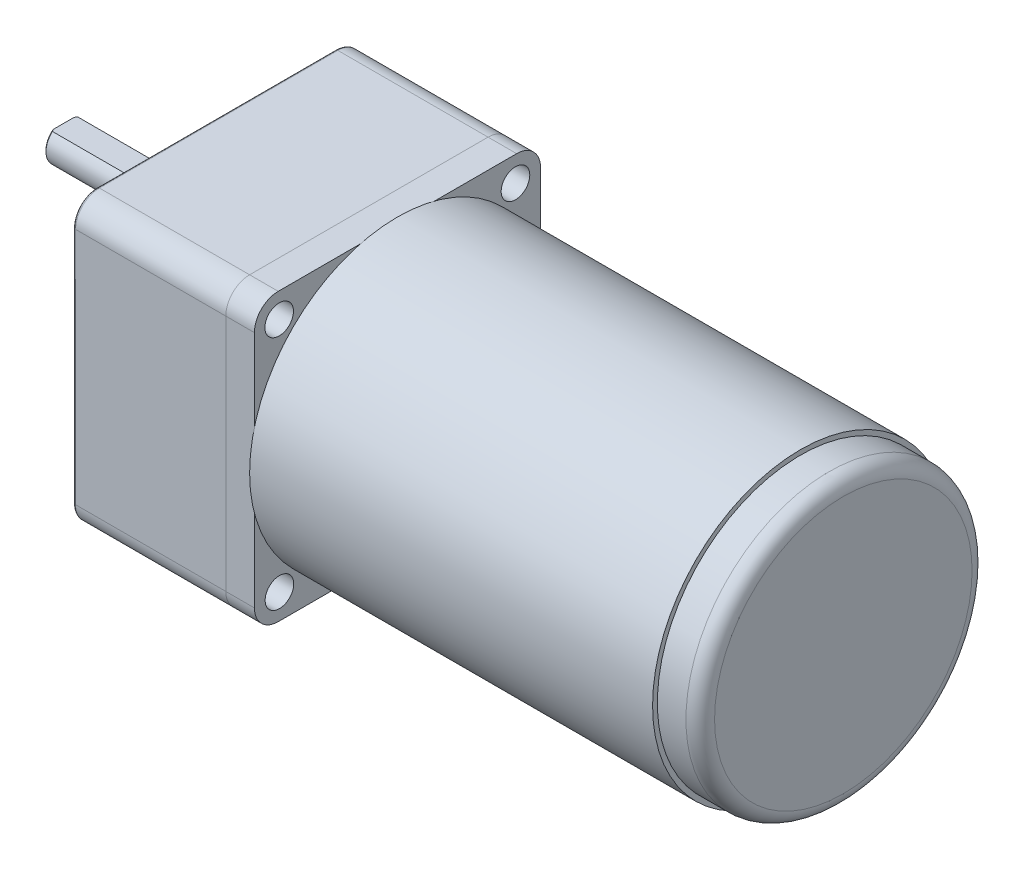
SolidWorks part; units mm, degrees
ref_plane "前视基准面" through (0, 0, 0) normal (0, 0, 1) x (1, 0, 0)
ref_plane "上视基准面" through (0, 0, 0) normal (0, 1, 0) x (1, 0, 0)
ref_plane "右视基准面" through (0, 0, 0) normal (1, 0, 0) x (0, 0, -1)
sketch "草图1" plane through (0, 0, 0) normal (1, 0, 0) x (0, 0, -1)
  line L1 (-25, -30) -> (25, -30)
  line L2 (-30, -25) -> (-30, 25)
  line L3 (-25, 30) -> (25, 30)
  line L4 (30, -25) -> (30, 25)
  line L5 (-30, -30) -> (30, 30) construction
  line L6 (-30, 30) -> (30, -30) construction
  arc A0 (-25, -30) -> (-30, -25) centre (-25, -25) cw
  arc A1 (25, -30) -> (30, -25) centre (25, -25) ccw
  arc A2 (25, 30) -> (30, 25) centre (25, 25) cw
  arc A3 (-30, 25) -> (-25, 30) centre (-25, 25) cw
  point P0 (0, 0)
  dimension "D1" = 5
extrude "凸台-拉伸1" add sketch "草图1" along normal blind 32
sketch "草图2" plane through (32, 0, 0) normal (1, 0, 0) x (0, 0, -1)
  line L0 (25, 30) -> (-25, 30) construction
  line L1 (-25, -30) -> (25, -30)
  line L2 (-30, -25) -> (-30, 25)
  line L3 (-25, 30) -> (25, 30)
  line L4 (30, -25) -> (30, 25)
  line L5 (-30, -30) -> (30, 30) construction
  line L6 (-30, 30) -> (30, -30) construction
  arc A0 (25, 30) -> (30, 25) centre (25, 25) cw
  arc A1 (25, -30) -> (30, -25) centre (25, -25) ccw
  arc A2 (-25, -30) -> (-30, -25) centre (-25, -25) cw
  arc A3 (-30, 25) -> (-25, 30) centre (-25, 25) cw
  point P0 (0, 0)
  dimension "D1" = 5
extrude "凸台-拉伸2" add sketch "草图2" along normal blind 6 separate body
sketch "草图5" plane through (0, 0, 0) normal (-1, 0, 0) x (0, 0, 1)
  circle A0 centre (0, 10) radius 12
extrude "凸台-拉伸5" add sketch "草图5" along normal blind 3 separate body
sketch "草图6" plane through (-3, 0, 0) normal (-1, 0, 0) x (0, 0, 1)
  circle A0 centre (0, 10) radius 4
extrude "凸台-拉伸6" add sketch "草图6" along normal blind 29 separate body
fillet "圆角2" radius 0.5 1 edges at (-3, 10, 12)
sketch "草图7" plane through (-32, 0, 0) normal (-1, 0, 0) x (0, 0, 1)
  line L2 (2.6458, 13) -> (-2.6458, 13)
  arc A0 (2.6458, 13) -> (-2.6458, 13) centre (0, 10) ccw
extrude "切除-拉伸1" cut sketch "草图7" against normal blind 25
chamfer "倒角1" distance 0.3 angle 45 1 edges at (-32, 6, 0)
sketch "草图8" plane through (0, 0, 0) normal (-1, 0, 0) x (0, 0, 1)
  circle A0 centre (0, 0) radius 26.3
extrude "切除-拉伸2" cut sketch "草图8" against normal blind 0.5
fillet "圆角3" radius 0.5 1 edges at (0, 0, 26.3)
fillet "圆角4" radius 0.5 8 edges at (0, -30, 0) (0, -28.5355, -28.5355) (0, 0, -30) (0, 28.5355, -28.5355) (0, 30, 0) (0, 28.5355, 28.5355) (0, 0, 30) (0, -28.5355, 28.5355)
sketch "草图9" plane through (0, 0, 0) normal (-1, 0, 0) x (0, 0, 1)
  point P19 (-24.7487, 24.7487)
  point P20 (24.7487, 24.7487)
  point P21 (24.7487, -24.7487)
  point P22 (-24.7487, -24.7487)
hole_wizard "M4 螺纹孔1" positions "3D草图1" profile "草图10" tap size "M4" standard "GB"
sketch3d "3D草图1"
  point P0 (0, 24.7487, -24.7487)
  point P3 (0, 24.7487, 24.7487)
  point P6 (0, -24.7487, 24.7487)
  point P9 (0, -24.7487, -24.7487)
sketch "草图10" plane through (0, 24.7487, -24.7487) normal (0, 1, 0) x (0, 0, 1)
  line L0 (0, 0) -> (0, 12.9914)
  line L1 (0, 12.9914) -> (1.65, 12)
  line L2 (1.65, 12) -> (1.65, 0)
  line L5 (1.65, 0) -> (0, 0)
  line L10 (0, 12.9914) -> (-1.65, 12) construction
  line L11 (0, -6.35) -> (0, 107.95) construction
  dimension "螺纹孔钻头直径" = 3.3
  dimension "螺纹孔钻头深度" = 12
  dimension "导头角度" = 118
sketch "草图11" plane through (38, 0, 0) normal (1, 0, 0) x (0, 0, -1)
  circle A5 centre (-24.8007, 24.8007) radius 3
  circle A6 centre (24.7487, 24.7487) radius 3
  circle A7 centre (24.7487, -24.7487) radius 3
  circle A8 centre (-24.7487, -24.7487) radius 3
extrude "切除-拉伸3" cut sketch "草图11" against normal blind 26
sketch "草图12" plane through (38, 0, 0) normal (1, 0, 0) x (0, 0, -1)
  circle A0 centre (0, 0) radius 31
extrude "凸台-拉伸7" add sketch "草图12" along normal blind 84.5 separate body
sketch "草图13" plane through (122.5, 0, 0) normal (1, 0, 0) x (0, 0, -1)
  circle A0 centre (0, 0) radius 30
extrude "凸台-拉伸8" add sketch "草图13" along normal blind 9 separate body
fillet "圆角5" radius 3 1 edges at (131.5, 0, -30)
